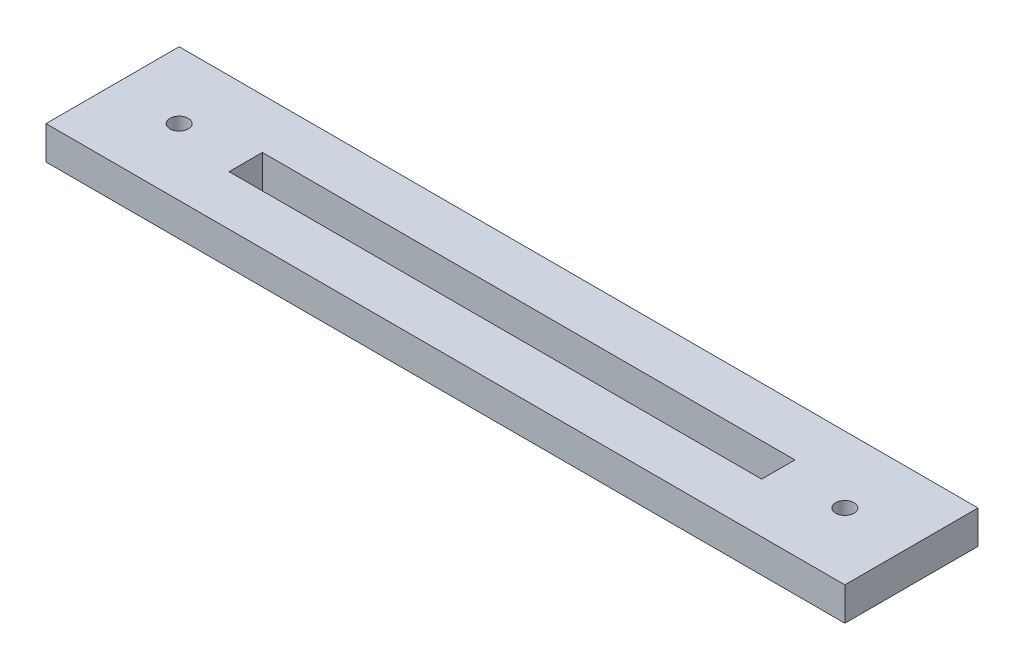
SolidWorks part; units mm, degrees
ref_plane "Front Plane" through (0, 0, 0) normal (0, 0, 1) x (1, 0, 0)
ref_plane "Top Plane" through (0, 0, 0) normal (0, 1, 0) x (1, 0, 0)
ref_plane "Right Plane" through (0, 0, 0) normal (1, 0, 0) x (0, 0, -1)
sketch "Sketch1" plane through (0, 0, 0) normal (0, 1, 0) x (1, 0, 0)
  line L0 (50.8, 0) -> (76.2, 0) construction
  line L1 (-76.2, -12.7) -> (76.2, -12.7)
  line L2 (-76.2, -12.7) -> (-76.2, 12.7)
  line L3 (-76.2, 12.7) -> (76.2, 12.7)
  line L4 (76.2, -12.7) -> (76.2, 12.7)
  line L5 (-76.2, -12.7) -> (76.2, 12.7) construction
  line L6 (-76.2, 12.7) -> (76.2, -12.7) construction
  line L7 (-50.8, -3.175) -> (50.8, -3.175)
  line L8 (-50.8, -3.175) -> (-50.8, 3.175)
  line L9 (-50.8, 3.175) -> (50.8, 3.175)
  line L10 (50.8, -3.175) -> (50.8, 3.175)
  line L11 (-50.8, -3.175) -> (50.8, 3.175) construction
  line L12 (-50.8, 3.175) -> (50.8, -3.175) construction
  line L13 (0, 12.7) -> (0, -12.7) construction
  circle A0 centre (63.5, 0) radius 1.75
  circle A1 centre (-63.5, 0) radius 1.75
  point P0 (0, 0)
  point P6 (0, 0)
  point P16 (63.5, 0)
  dimension "D5" = 3.5
  dimension "D1" = 152.4
  dimension "D2" = 25.4
  dimension "D3" = 6.35
  dimension "D4" = 101.6
extrude "Boss-Extrude1" add sketch "Sketch1" along normal blind 6.35
